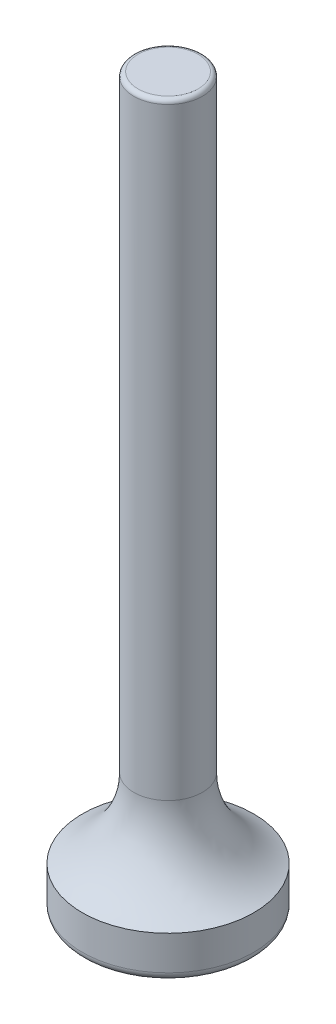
SolidWorks part; units mm, degrees
ref_plane "Front Plane" through (0, 0, 0) normal (0, 0, 1) x (1, 0, 0)
ref_plane "Top Plane" through (0, 0, 0) normal (0, 1, 0) x (1, 0, 0)
ref_plane "Right Plane" through (0, 0, 0) normal (1, 0, 0) x (0, 0, -1)
sketch "Sketch1" plane through (0, 0, 0) normal (0, 1, 0) x (1, 0, 0)
  line L0 (-55, 0) -> (55, 0) construction
  circle A0 centre (0, 0) radius 4
extrude "Boss-Extrude1" add sketch "Sketch1" along normal blind 80
sketch "Sketch2" plane through (0, 0, 0) normal (0, -1, 0) x (1, 0, 0)
  circle A0 centre (0, 0) radius 10
extrude "Boss-Extrude2" add sketch "Sketch2" along normal blind 5 contours A0
fillet "Fillet1" radius 10 1 edges at (0, 0, -4)
fillet "Fillet2" radius 1 1 edges at (0, -5, -10)
fillet "Fillet3" radius 0.5 1 edges at (0, 80, 4)
